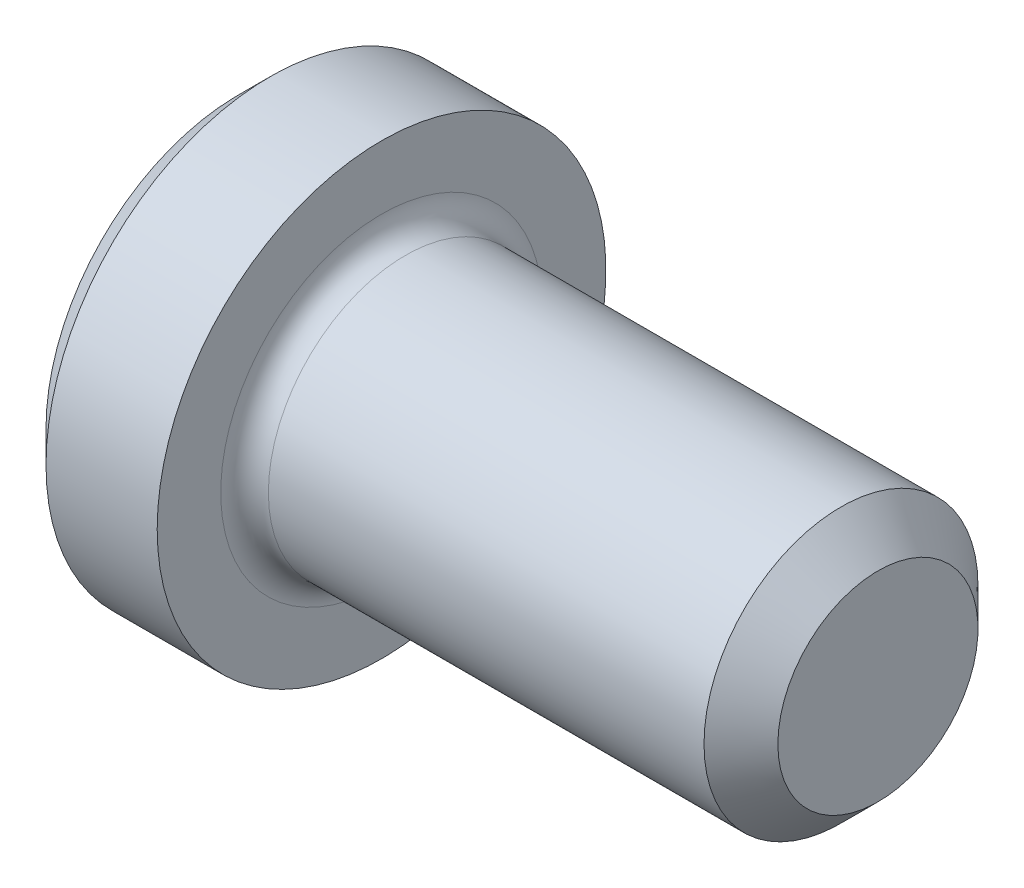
SolidWorks part; units mm, degrees
ref_plane "Plane1" through (0, 0, 0) normal (0, 0, 1) x (1, 0, 0)
ref_plane "Plane2" through (0, 0, 0) normal (0, 1, 0) x (1, 0, 0)
ref_plane "Plane3" through (0, 0, 0) normal (1, 0, 0) x (0, 0, -1)
sketch "BodySke" plane through (0, 0, 0) normal (0, 0, 1) x (1, 0, 0)
  line L0 (0, 0) -> (0, 2.4638)
  line L1 (0.4064, 2.8702) -> (1.8288, 2.8702)
  line L2 (1.8288, 2.8702) -> (1.8288, 1.7526)
  line L3 (1.8288, 1.7526) -> (7.7064, 1.7526)
  line L4 (8.1788, 1.2802) -> (8.1788, 0)
  line L5 (8.1788, 0) -> (0, 0)
  line L6 (-5.4309, 0) -> (13.5173, 0) construction
  line L7 (0, 2.4638) -> (0.4064, 2.8702)
  line L8 (8.1788, 1.2802) -> (7.7064, 1.7526)
  line L9 (0, -2.4638) -> (0.4064, -2.8702) construction
  line L10 (8.1788, -1.2802) -> (7.7064, -1.7526) construction
  dimension "D1" = 0.4724
  dimension "D2" = 0.4064
  dimension "Diameter" = 3.5052
  dimension "Head_ht" = 1.8288
  dimension "Length" = 6.35
  dimension "Body_ch_ang" = 45
  dimension "Head_dia" = 5.7404
  dimension "Head_ch_ang" = 45
revolve "Base-Revolve" add sketch "BodySke"
fillet "Fillet1" radius 0.3048 1 edges at (1.8288, 0, 1.7526)
sketch "Sketch2" plane through (0, 0, 0) normal (0, 0, 1) x (1, 0, 0)
  line L0 (0, 0.7874) -> (1.5748, 0.7874)
  line L1 (1.5748, 0.7874) -> (2.0294, 0)
  line L2 (-5.4309, 0) -> (13.5173, 0) construction
  line L3 (2.0294, 0) -> (0, 0)
  line L4 (0, 0) -> (0, 0.7874)
  line L5 (0, 2.4638) -> (0, -2.4638) construction
  line L6 (0, 0) -> (47.625, 0) construction
  line L7 (1.8288, -2.8702) -> (1.8288, 2.8702) construction
  dimension "D1" = 0.7874
  dimension "D2" = 60
  dimension "Wall_thickness" = 0.254
revolve "Hex-PreBroach" cut sketch "Sketch2" angle 360 about L6
sketch "Sketch3" plane through (0, 0, 0) normal (-1, 0, 0) x (0, 0.5, 0.866)
  line L0 (0.4546, 0.7874) -> (-0.4546, 0.7874)
  line L1 (-0.4546, 0.7874) -> (-0.9092, 0)
  line L2 (0.4546, 0.7874) -> (0.9092, 0)
  line L3 (0.4546, -0.7874) -> (0.9092, 0)
  line L4 (0.4546, -0.7874) -> (-0.4546, -0.7874)
  line L5 (-0.4546, -0.7874) -> (-0.9092, 0)
  circle A0 centre (0, 0) radius 0.7874 construction
  dimension "D1" = 0.7874
  dimension "D2" = 0.7874
  dimension "Hex_size" = 1.5748
extrude "Hex" cut sketch "Sketch3" against normal blind 1.5748
equation "\"D2@Sketch3\" = \"Hex_size@Sketch3\" / 2"
equation "\"D1@Sketch3\" = \"Hex_size@Sketch3\" / 2"
equation "\"D1@Sketch2\" = \"Hex_size@Sketch3\" / 2"
equation "\"Wall_thickness@Sketch2\" = \"Head_ht@BodySke\" - \"Key_eng@Hex\""
